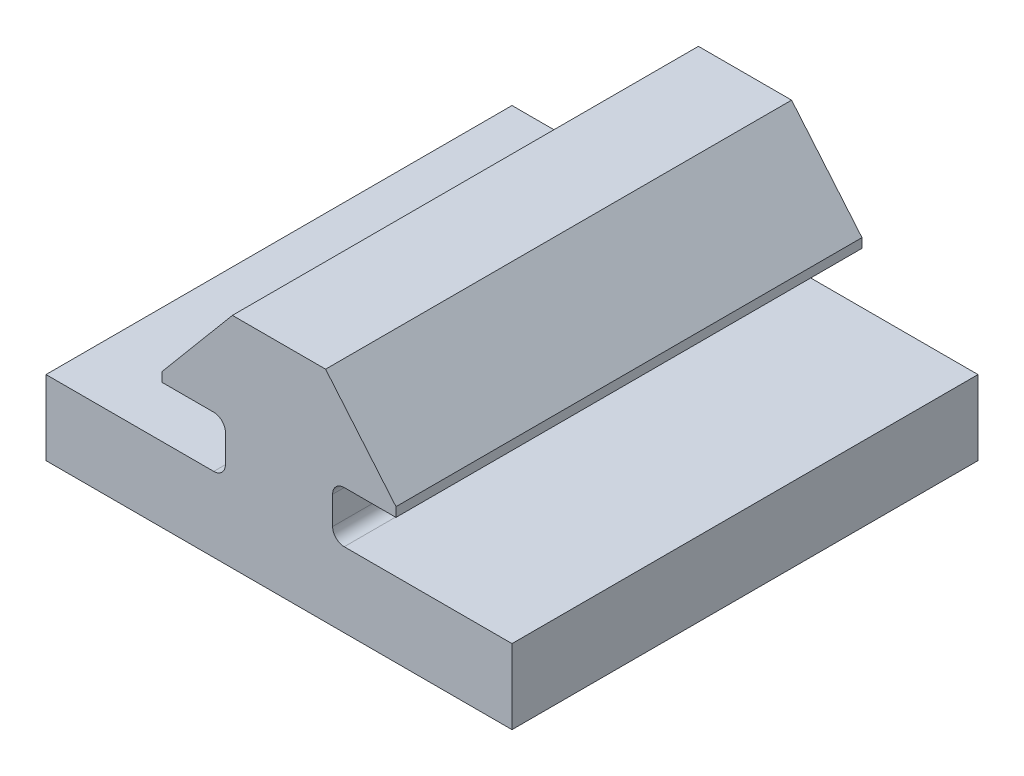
SolidWorks part; units mm, degrees
ref_plane "Front Plane" through (0, 0, 0) normal (0, 0, 1) x (1, 0, 0)
ref_plane "Top Plane" through (0, 0, 0) normal (0, 1, 0) x (1, 0, 0)
ref_plane "Right Plane" through (0, 0, 0) normal (1, 0, 0) x (0, 0, -1)
imported_body "6710-CL145.sldprt"
sketch "Sketch1" plane through (0, 0, 0) normal (0, 0, 1) x (1, 0, 0)
  line L1 (-15.4388, -2.1511) -> (16.907, -2.1511)
  line L2 (-15.4388, -2.1511) -> (-15.4388, 16.1259)
  line L3 (-15.4388, 16.1259) -> (16.907, 16.1259)
  line L4 (16.907, -2.1511) -> (16.907, 16.1259)
extrude "Cut-Extrude2" cut sketch "Sketch1" against normal blind 3657.6
